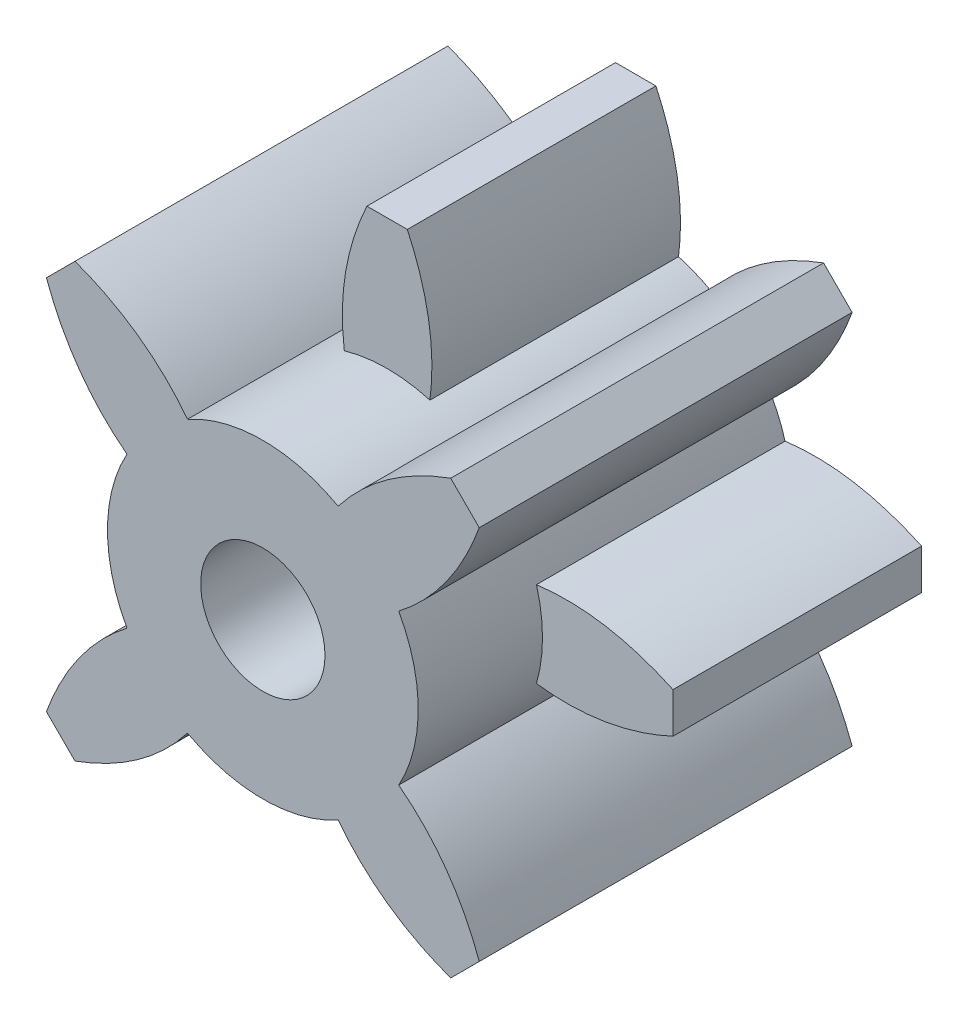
SolidWorks part; units mm, degrees
ref_plane "前基準面" through (0, 0, 0) normal (0, 0, 1) x (1, 0, 0)
ref_plane "上基準面" through (0, 0, 0) normal (0, 1, 0) x (1, 0, 0)
ref_plane "右基準面" through (0, 0, 0) normal (1, 0, 0) x (0, 0, -1)
sketch "草圖1" plane through (0, 0, 0) normal (0, 0, 1) x (1, 0, 0)
  line L0 (0, 0) -> (0, 50) construction
  line L1 (0, 0) -> (7.8217, 49.3844) construction
  line L2 (0, 0) -> (-7.8217, 49.3844) construction
  line L3 (0, 0) -> (2.0673, 39.4459) construction
  line L4 (0, 0) -> (-2.0673, 39.4459) construction
  line L5 (-6.6046, 49.5619) -> (-7.8217, 49.3844)
  line L6 (6.6046, 49.5619) -> (7.8217, 49.3844)
  circle A0 centre (0, 0) radius 7
  circle A1 centre (0, 0) radius 39.5
  circle A2 centre (0, 0) radius 45 construction
  circle A3 centre (0, 0) radius 50 construction
  spline S0 degree 2 poles (-2.0673, 39.4459) (-2.884, 45.4275) (-6.6046, 49.5619) knots 0 0 0 1 1 1
  spline S1 degree 2 poles (2.0673, 39.4459) (2.884, 45.4275) (6.6046, 49.5619) knots 0 0 0 1 1 1
  dimension "D1" = 100
  dimension "D2" = 90
  dimension "D3" = 79
  dimension "D4" = 14
  dimension "D5" = 9
  dimension "D7" = 6
  dimension "D8" = 1.23
sketch "草圖2" plane through (0, 0, 0) normal (0, 0, 1) x (1, 0, 0)
  line L0 (0, 63) -> (0, 50) construction
  line L1 (0, 63) -> (-6.8883, 46.3702) construction
  line L2 (0, 63) -> (6.8883, 46.3702) construction
  line L3 (0, 63) -> (-3.4455, 50.9842) construction
  line L4 (0, 63) -> (3.4455, 50.9842) construction
  line L5 (-1.625, 40) -> (1.625, 40)
  line L7 (0, 0) -> (0, 50) construction
  circle A0 centre (0, 63) radius 5
  circle A1 centre (0, 0) radius 7 construction
  circle A2 centre (0, 63) radius 12.5
  circle A3 centre (0, 63) radius 18 construction
  circle A4 centre (0, 0) radius 45 construction
  spline S0 degree 2 poles (-1.625, 40) (-4.1616, 45.4635) (-3.4455, 50.9842) knots 0 0 0 1 1 1
  spline S1 degree 2 poles (1.625, 40) (4.1616, 45.4635) (3.4455, 50.9842) knots 0 0 0 1 1 1
  point P17 (0, 40)
  dimension "D1" = 63
  dimension "D2" = 10
  dimension "D3" = 25
  dimension "D4" = 45
  dimension "D5" = 22.5
  dimension "D6" = 32
  dimension "D7" = 3.25
  dimension "D8" = 23
sketch "草圖3" plane through (0, 0, 0) normal (0, 0, 1) x (1, 0, 0)
  line L0 (-1.625, 40) -> (1.625, 40) construction
  line L1 (-1.625, 40) -> (1.625, 40)
  line L2 (15.1144, 45.5875) -> (17.4125, 47.8856)
  line L3 (23, 61.375) -> (23, 64.625)
  line L4 (17.4125, 78.1144) -> (15.1144, 80.4125)
  line L5 (1.625, 86) -> (-1.625, 86)
  line L6 (-15.1144, 80.4125) -> (-17.4125, 78.1144)
  line L7 (-23, 64.625) -> (-23, 61.375)
  line L8 (-17.4125, 47.8856) -> (-15.1144, 45.5875)
  circle A0 centre (0, 63) radius 12.5 construction
  arc A1 (-3.4455, 50.9842) -> (3.4455, 50.9842) centre (0, 63) ccw
  arc A2 (6.0601, 52.0673) -> (10.9327, 56.9399) centre (0, 63) ccw
  arc A3 (12.0158, 59.5545) -> (12.0158, 66.4455) centre (0, 63) ccw
  arc A4 (10.9327, 69.0601) -> (6.0601, 73.9327) centre (0, 63) ccw
  arc A5 (3.4455, 75.0158) -> (-3.4455, 75.0158) centre (0, 63) ccw
  arc A6 (-6.0601, 73.9327) -> (-10.9327, 69.0601) centre (0, 63) ccw
  arc A7 (-12.0158, 66.4455) -> (-12.0158, 59.5545) centre (0, 63) ccw
  arc A8 (-10.9327, 56.9399) -> (-6.0601, 52.0673) centre (0, 63) ccw
  parabola Q0 construction
  parabola Q1 construction
  parabola Q2
  parabola Q3
  parabola Q4
  parabola Q5
  parabola Q6
  parabola Q7
  parabola Q8
  parabola Q9
  parabola Q10
  parabola Q11
  parabola Q12
  parabola Q13
  parabola Q14
  parabola Q15
  parabola Q16
  parabola Q17
  point P73 (0, 63)
  dimension "D1" = 8
extrude "填料-伸長1" add sketch "草圖3" against normal blind 30
sketch "草圖4" plane through (0, 0, 0) normal (0, 0, 1) x (1, 0, 0)
  circle A0 centre (0, 63) radius 5 construction
  circle A1 centre (0, 63) radius 12.5 construction
  circle A2 centre (0, 63) radius 5
  circle A3 centre (0, 63) radius 12.5
extrude "填料-伸長2" add sketch "草圖4" against normal blind 30
sketch "草圖5" plane through (0, 0, 0) normal (0, 0, 1) x (1, 0, 0)
  line L8 (-1.625, 40) -> (1.625, 40)
  line L9 (15.1144, 45.5875) -> (17.4125, 47.8856)
  line L10 (23, 61.375) -> (23, 64.625)
  line L11 (17.4125, 78.1144) -> (15.1144, 80.4125)
  line L12 (1.625, 86) -> (-1.625, 86)
  line L13 (-15.1144, 80.4125) -> (-17.4125, 78.1144)
  line L14 (-23, 64.625) -> (-23, 61.375)
  line L15 (-17.4125, 47.8856) -> (-15.1144, 45.5875)
  line L16 (-1.625, 40) -> (1.625, 40)
  line L18 (23, 61.375) -> (23, 64.625)
  line L20 (1.625, 86) -> (-1.625, 86)
  line L22 (-23, 64.625) -> (-23, 61.375)
  arc A0 (-12.0158, 66.4455) -> (-12.0158, 59.5545) centre (0, 63) ccw
  arc A1 (3.4455, 75.0158) -> (-3.4455, 75.0158) centre (0, 63) ccw
  arc A2 (12.0158, 59.5545) -> (12.0158, 66.4455) centre (0, 63) ccw
  arc A3 (-3.4455, 50.9842) -> (3.4455, 50.9842) centre (0, 63) ccw
  arc A8 (3.4455, 50.9842) -> (6.0601, 52.0673) centre (0, 63) ccw
  arc A9 (10.9327, 56.9399) -> (12.0158, 59.5545) centre (0, 63) ccw
  arc A10 (12.0158, 66.4455) -> (10.9327, 69.0601) centre (0, 63) ccw
  arc A11 (6.0601, 73.9327) -> (3.4455, 75.0158) centre (0, 63) ccw
  arc A12 (-3.4455, 75.0158) -> (-6.0601, 73.9327) centre (0, 63) ccw
  arc A13 (-10.9327, 69.0601) -> (-12.0158, 66.4455) centre (0, 63) ccw
  arc A14 (-12.0158, 59.5545) -> (-10.9327, 56.9399) centre (0, 63) ccw
  arc A15 (-6.0601, 52.0673) -> (-3.4455, 50.9842) centre (0, 63) ccw
  parabola Q16
  parabola Q17
  parabola Q18
  parabola Q19
  parabola Q20
  parabola Q21
  parabola Q22
  parabola Q23
  parabola Q24
  parabola Q25
  parabola Q26
  parabola Q27
  parabola Q28
  parabola Q29
  parabola Q30
  parabola Q31
  parabola Q32
  parabola Q33
  parabola Q36
  parabola Q37
  parabola Q40
  parabola Q41
  parabola Q44
  parabola Q45
  dimension "D1" = 0
extrude "除料-伸長1" cut sketch "草圖5" against normal blind 10
